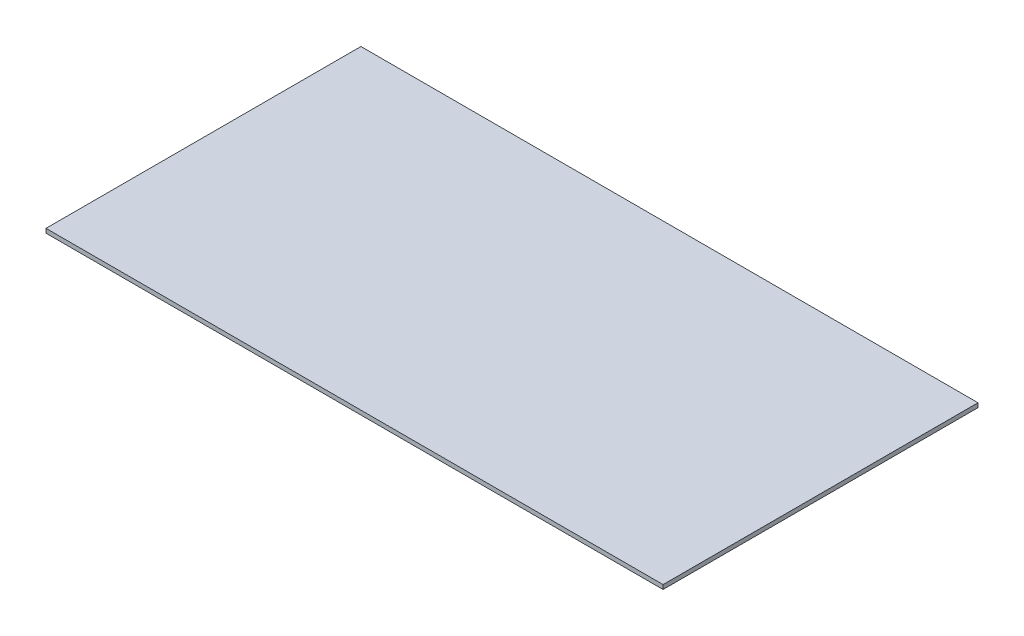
SolidWorks part; units mm, degrees
ref_plane "Plan de face" through (0, 0, 0) normal (0, 0, 1) x (1, 0, 0)
ref_plane "Plan de dessus" through (0, 0, 0) normal (0, 1, 0) x (1, 0, 0)
ref_plane "Plan de droite" through (0, 0, 0) normal (1, 0, 0) x (0, 0, -1)
sketch "Esquisse1" plane through (0, 0, 0) normal (0, 0, 1) x (1, 0, 0)
  line L1 (0, 0) -> (435, 0)
  line L2 (0, 0) -> (0, 3)
  line L3 (0, 3) -> (435, 3)
  line L4 (435, 0) -> (435, 3)
  dimension "D1" = 435
  dimension "D2" = 3
extrude "Extrusion1" add sketch "Esquisse1" along normal blind 222
